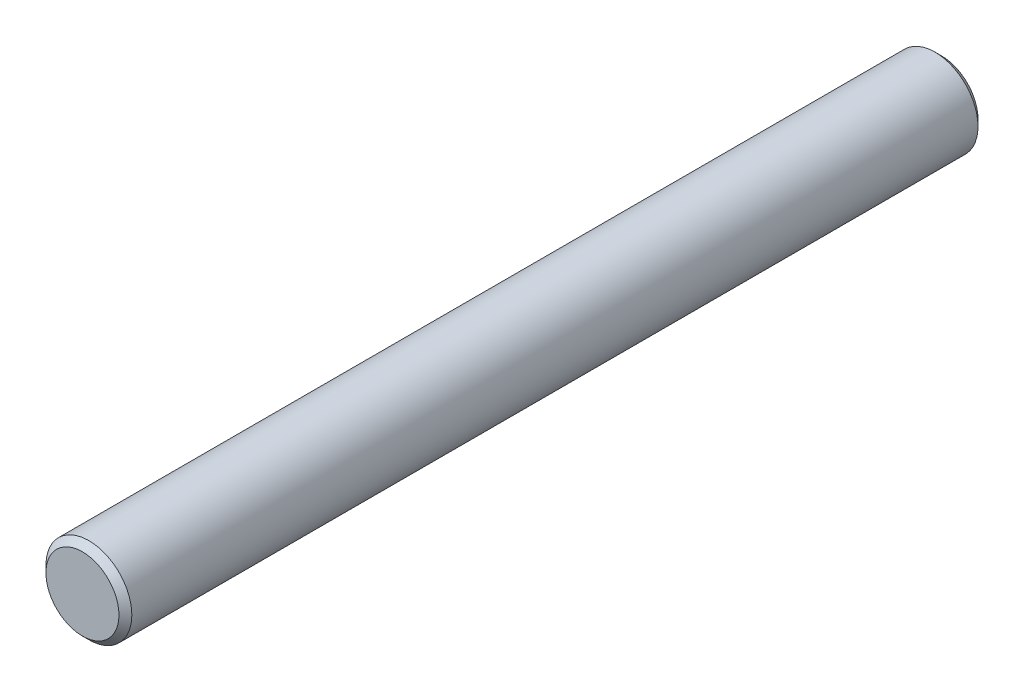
SolidWorks part; units mm, degrees
ref_plane "Спереди" through (0, 0, 0) normal (0, 0, 1) x (1, 0, 0)
ref_plane "Сверху" through (0, 0, 0) normal (0, 1, 0) x (1, 0, 0)
ref_plane "Справа" through (0, 0, 0) normal (1, 0, 0) x (0, 0, -1)
sketch "Эскиз1" plane through (0, 0, 0) normal (0, 0, 1) x (1, 0, 0)
  circle A0 centre (0, 0) radius 1
  dimension "D1" = 2
extrude "Бобышка-Вытянуть1" add sketch "Эскиз1" along normal blind 20
chamfer "Фаска1" distance 0.15 angle 45 2 edges at (1, 0, 0) (1, 0, 20)
